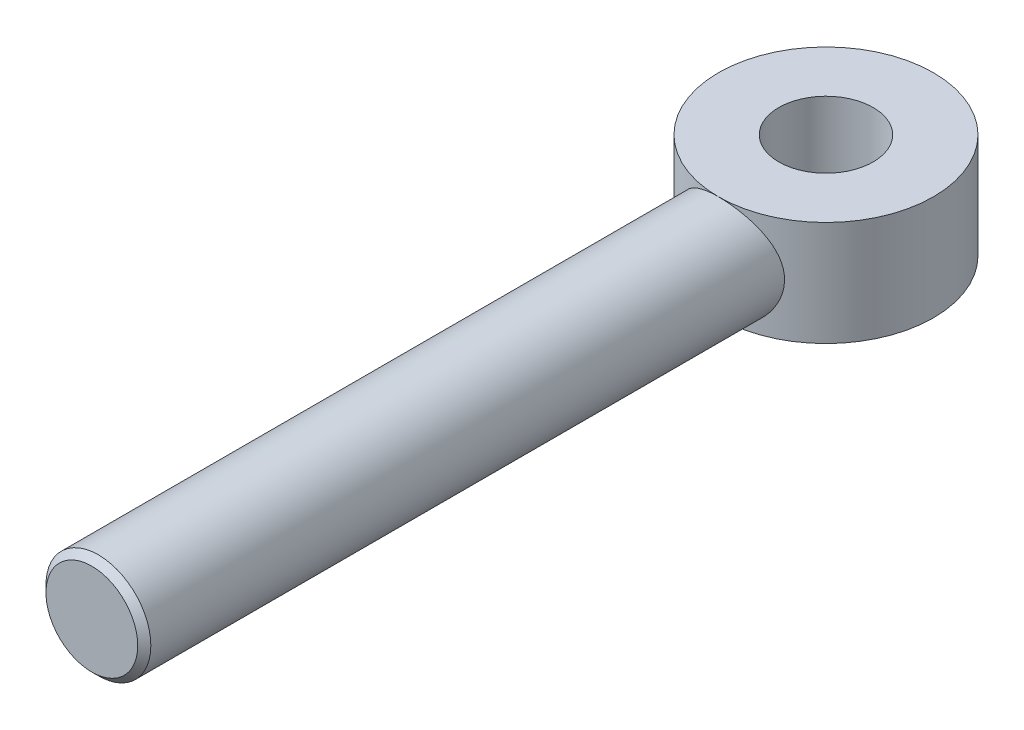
SolidWorks part; units mm, degrees
ref_plane "Plan de face" through (0, 0, 0) normal (0, 0, 1) x (1, 0, 0)
ref_plane "Plan de dessus" through (0, 0, 0) normal (0, 1, 0) x (1, 0, 0)
ref_plane "Plan de droite" through (0, 0, 0) normal (1, 0, 0) x (0, 0, -1)
sketch "Esquisse1" plane through (0, 0, 0) normal (0, 0, 1) x (1, 0, 0)
  circle A0 centre (0, 0) radius 10
  dimension "D1" = 20
extrude "Boss.-Extru.1" add sketch "Esquisse1" along normal blind 140
chamfer "Chanfrein1" distance 1.25 angle 45 2 edges at (10, 0, 0) (10, 0, 140)
sketch "Esquisse2" plane through (0, 0, 0) normal (0, 1, 0) x (1, 0, 0)
  circle A0 centre (0, 0) radius 20.5
  dimension "D1" = 41
extrude "Boss.-Extru.2" add sketch "Esquisse2" along normal mid plane 20
sketch "Esquisse3" plane through (0, 10, 0) normal (0, 1, 0) x (1, 0, 0)
  circle A0 centre (0, 0) radius 9
  dimension "D1" = 18
extrude "Enlèv. mat.-Extru.1" cut sketch "Esquisse3" against normal through all
